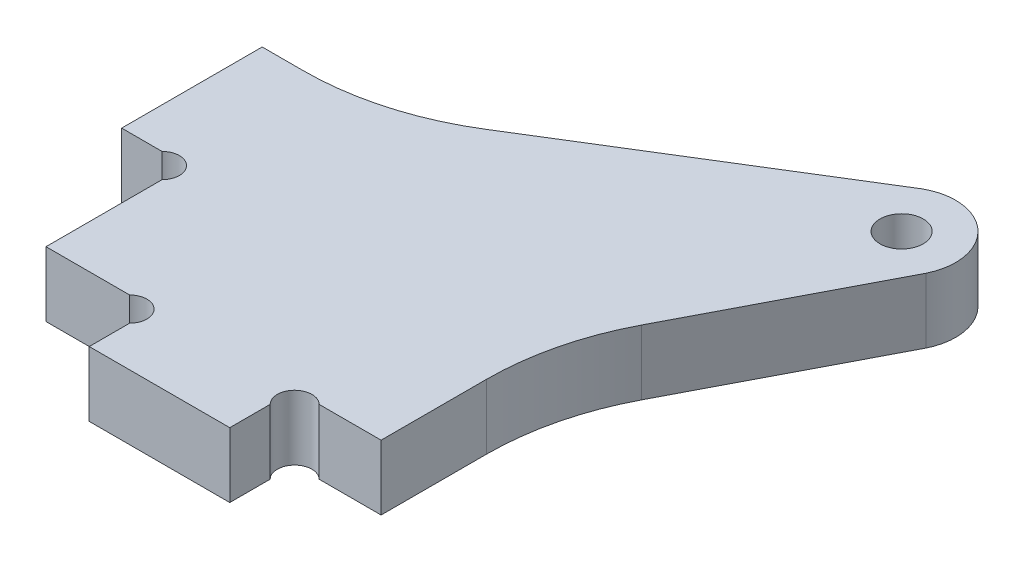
SolidWorks part; units mm, degrees
ref_plane "Face" through (0, 0, 0) normal (0, 0, 1) x (1, 0, 0)
ref_plane "Dessus" through (0, 0, 0) normal (0, 1, 0) x (1, 0, 0)
ref_plane "Droite" through (0, 0, 0) normal (1, 0, 0) x (0, 0, -1)
sketch "Esquisse1" plane through (0, 0, 0) normal (0, 1, 0) x (1, 0, 0)
  line L0 (-21.9038, 0) -> (62.2595, 0) construction
  line L1 (0, -12.011) -> (0, 52.4687) construction
  line L2 (-21.9038, 41) -> (62.2595, 41) construction
  line L3 (39, -12.011) -> (39, 52.4687) construction
  line L4 (-21.9038, 26) -> (18.1267, 26) construction
  line L5 (-12.5989, 13) -> (3.3802, 13) construction
  line L6 (23, 4.7572) -> (23, -12.011) construction
  line L7 (10, 4.7572) -> (10, -12.011) construction
  line L8 (-6, 52.4687) -> (-6, -1.9307) construction
  line L9 (62.2595, -6) -> (-1.937, -6) construction
  line L10 (0, 0) -> (38.35, 40.8) construction
  line L11 (31, -12.011) -> (31, 20.1685) construction
  line L12 (-6, 26) -> (-6, 13)
  line L13 (-6, 13) -> (-2.2627, 13)
  line L14 (-6, 26) -> (-2.2278, 26)
  line L15 (31, 9.7346) -> (31, 0)
  line L16 (42.824, 38.5677) -> (33.8242, 21.2774)
  line L17 (35.8291, 45.118) -> (10.9074, 29.7287)
  line L18 (0, 10.7373) -> (0, 0)
  line L19 (0, 0) -> (7.7373, 0)
  line L20 (10, -2.2627) -> (10, -6)
  line L21 (10, -6) -> (23, -6)
  line L22 (23, -6) -> (23, -2.2627)
  line L23 (25.2627, 0) -> (31, 0)
  line L24 (38.35, 48.0459) -> (38.35, 32.4829) construction
  line L25 (49.2831, 40.8) -> (35.017, 40.8) construction
  line L26 (16.5, 4.7572) -> (16.5, -0.8932) construction
  line L27 (23, 0) -> (34.11, -11.11) construction
  line L28 (0, 13) -> (-7.9013, 5.0987) construction
  circle A0 centre (38.35, 40.8) radius 2
  arc A1 (42.824, 38.5677) -> (35.8291, 45.118) centre (38.35, 40.8) ccw
  arc A2 (10.9074, 29.7287) -> (-2.2278, 26) centre (-2.2278, 51) cw
  arc A3 (33.8242, 21.2774) -> (31, 9.7346) centre (56, 9.7346) ccw
  arc A4 (25.2627, 0) -> (23, -2.2627) centre (24.1314, -1.1314) ccw
  arc A5 (7.7373, 0) -> (10, -2.2627) centre (8.8686, -1.1314) cw
  arc A6 (0, 10.7373) -> (-2.2627, 13) centre (-1.1314, 11.8686) ccw
  point P40 (4.869, 26)
  point P43 (31, 15.8515)
  dimension "D3" = 6
  dimension "D9" = 8
  dimension "D11" = 0.65
  dimension "D10" = 25
  dimension "D13" = 6.5
  dimension "D15" = 45
  dimension "D1" = 41
  dimension "D2" = 39
  dimension "D4" = 6
  dimension "D5" = 26
  dimension "D6" = 13
  dimension "D7" = 13
  dimension "D8" = 10
  dimension "D12" = 0.2
  dimension "D14" = 45
extrude "Extrusion1" add sketch "Esquisse1" along normal blind 6
